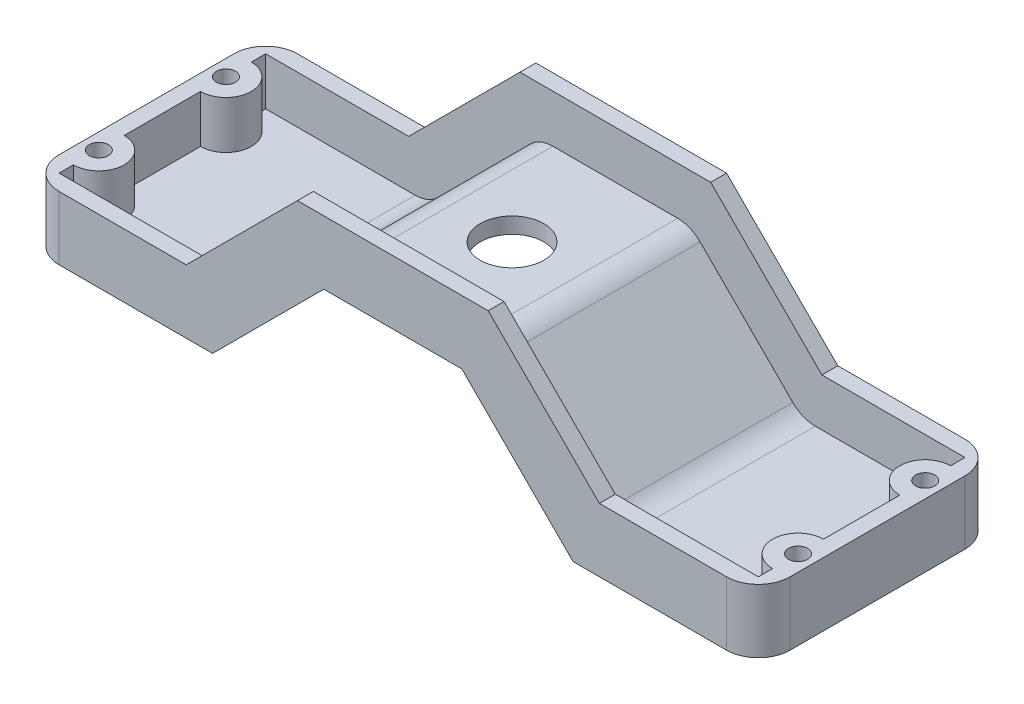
SolidWorks part; units mm, degrees
ref_plane "Front Plane" through (0, 0, 0) normal (0, 0, 1) x (1, 0, 0)
ref_plane "Top Plane" through (0, 0, 0) normal (0, 1, 0) x (1, 0, 0)
ref_plane "Right Plane" through (0, 0, 0) normal (1, 0, 0) x (0, 0, -1)
sketch "Sketch1" plane through (0, 0, 0) normal (0, 0, 1) x (1, 0, 0)
  line L0 (0, 0) -> (50, 0)
  line L1 (50, 0) -> (85, 35)
  line L2 (85, 35) -> (145, 35)
  line L3 (145, 35) -> (180, 0)
  line L4 (180, 0) -> (230, 0)
  dimension "D1" = 50
  dimension "D2" = 60
  dimension "D3" = 35
  dimension "D4" = 45
extrude "Extrude-Thin1" add sketch "Sketch1" along normal mid plane 75 thin
shell "Shell1" thickness 5
ref_plane "Plane1" through (115, 0, 0) normal (-1, 0, 0) x (0, 0, 1)
fillet "Fillet1" radius 10 4 edges at (230, -10, -37.5) (0, -10, -37.5) (230, -10, 37.5) (0, -10, 37.5)
fillet "Fillet2" radius 10 4 edges at (173.7868, -15, 0) (138.7868, 20, 0) (91.2132, 20, 0) (56.2132, -15, 0)
sketch "Sketch4" plane through (0, 0, 0) normal (0, 1, 0) x (1, 0, 0)
  line L0 (5, -32.5) -> (5, 32.5) construction
  line L1 (5, -32.5) -> (5, 32.5) construction
  line L2 (5, 28) -> (5, 12)
  arc A0 (5, 28) -> (5, 12) centre (5, 20) cw
  dimension "D1" = 8
  dimension "D2" = 20
extrude "Boss-Extrude3" add sketch "Sketch4" against normal up to next
sketch "Sketch5" plane through (0, 0, 0) normal (0, 1, 0) x (1, 0, 0)
  circle A0 centre (5, 20) radius 3
  dimension "D1" = 6
extrude "Cut-Extrude2" cut sketch "Sketch5" against normal through all
mirror "Mirror2" about plane through (0, 0, 0) normal (0, 0, 1) of "Cut-Extrude2", "Boss-Extrude3"
mirror "Mirror3" about plane through (115, 0, 0) normal (-1, 0, 0) of "Mirror2", "Boss-Extrude3", "Cut-Extrude2"
sketch "Sketch7" plane through (0, 15, 0) normal (0, -1, 0) x (1, 0, 0)
  line L0 (93.2843, -37.5) -> (136.7157, -37.5) construction
  circle A0 centre (115, 0) radius 10
  point P5 (115, -37.5)
  dimension "D1" = 20
extrude "Cut-Extrude4" cut sketch "Sketch7" against normal through all
